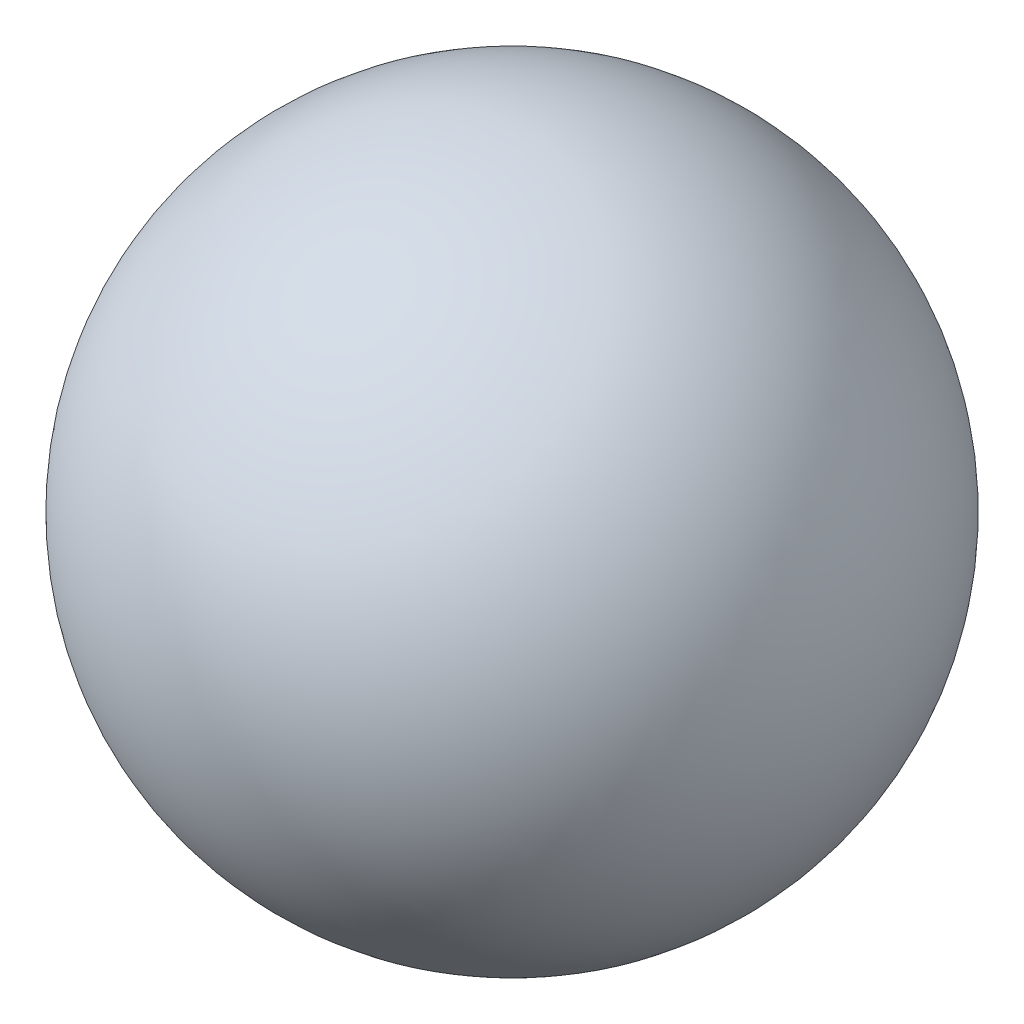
SolidWorks part; units mm, degrees
ref_plane "Front Plane" through (0, 0, 0) normal (0, 0, 1) x (1, 0, 0)
ref_plane "Top Plane" through (0, 0, 0) normal (0, 1, 0) x (1, 0, 0)
ref_plane "Right Plane" through (0, 0, 0) normal (1, 0, 0) x (0, 0, -1)
sketch "Sketch1" plane through (0, 0, 0) normal (0, 0, 1) x (1, 0, 0)
  line L0 (0, 201.6252) -> (0, -201.6252)
  arc A0 (0, -201.6252) -> (0, 201.6252) centre (0, 0) ccw
  dimension "D1" = 403.2504
revolve "Revolve1" add sketch "Sketch1" angle 360 about L0
